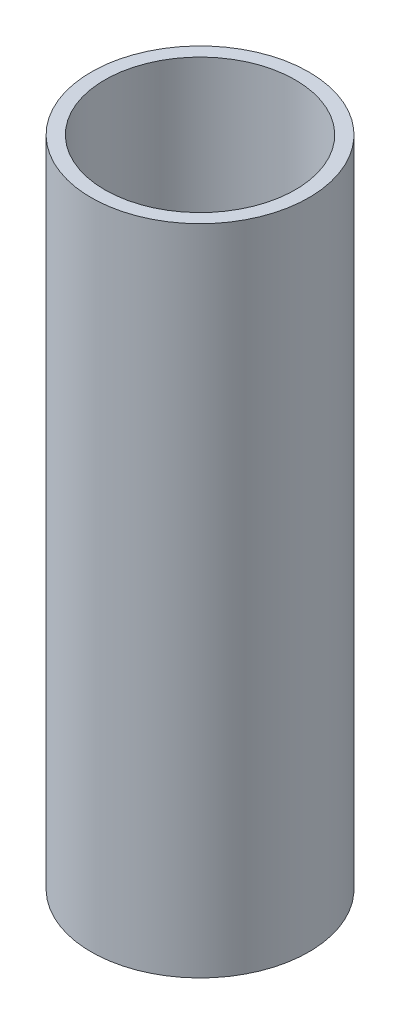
SolidWorks part; units mm, degrees
ref_plane "Front Plane" through (0, 0, 0) normal (0, 0, 1) x (1, 0, 0)
ref_plane "Top Plane" through (0, 0, 0) normal (0, 1, 0) x (1, 0, 0)
ref_plane "Right Plane" through (0, 0, 0) normal (1, 0, 0) x (0, 0, -1)
sketch "Sketch1" plane through (0, 0, 0) normal (0, 1, 0) x (1, 0, 0)
  circle A0 centre (0, 0) radius 12.7
extrude "Extrude1" add sketch "Sketch1" along normal blind 76.2
sketch "Sketch2" plane through (0, 76.2, 0) normal (0, 1, 0) x (1, 0, 0)
  circle A0 centre (0, 0) radius 11.1125
extrude "Extrude2" cut sketch "Sketch2" against normal through all
